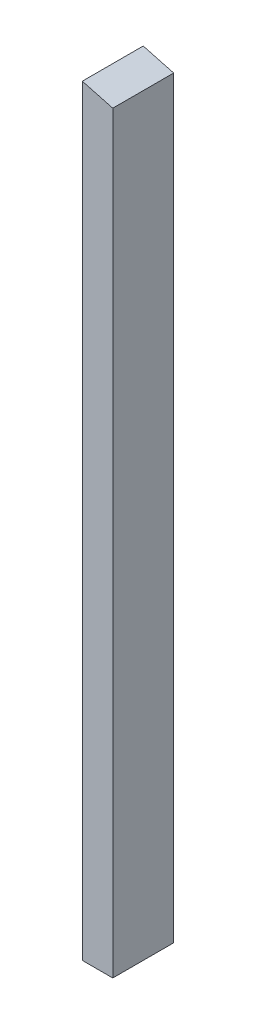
SolidWorks part; units mm, degrees
ref_plane "Face" through (0, 0, 0) normal (0, 0, 1) x (1, 0, 0)
ref_plane "Dessus" through (0, 0, 0) normal (0, 1, 0) x (1, 0, 0)
ref_plane "Droite" through (0, 0, 0) normal (1, 0, 0) x (0, 0, -1)
sketch "Esquisse1" plane through (0, 0, 0) normal (0, 0, 1) x (1, 0, 0)
  line L0 (2499.881, 3786.4066) -> (2539.881, 3775.6886)
  line L1 (2539.881, 3775.6886) -> (2539.881, 2786.4066)
  line L2 (2539.881, 2786.4066) -> (2499.881, 2786.4066)
  line L3 (2499.881, 2786.4066) -> (2499.881, 3786.4066)
extrude "Base-Extrusion" add sketch "Esquisse1" against normal blind 80
shell "Coque1" thickness 3
